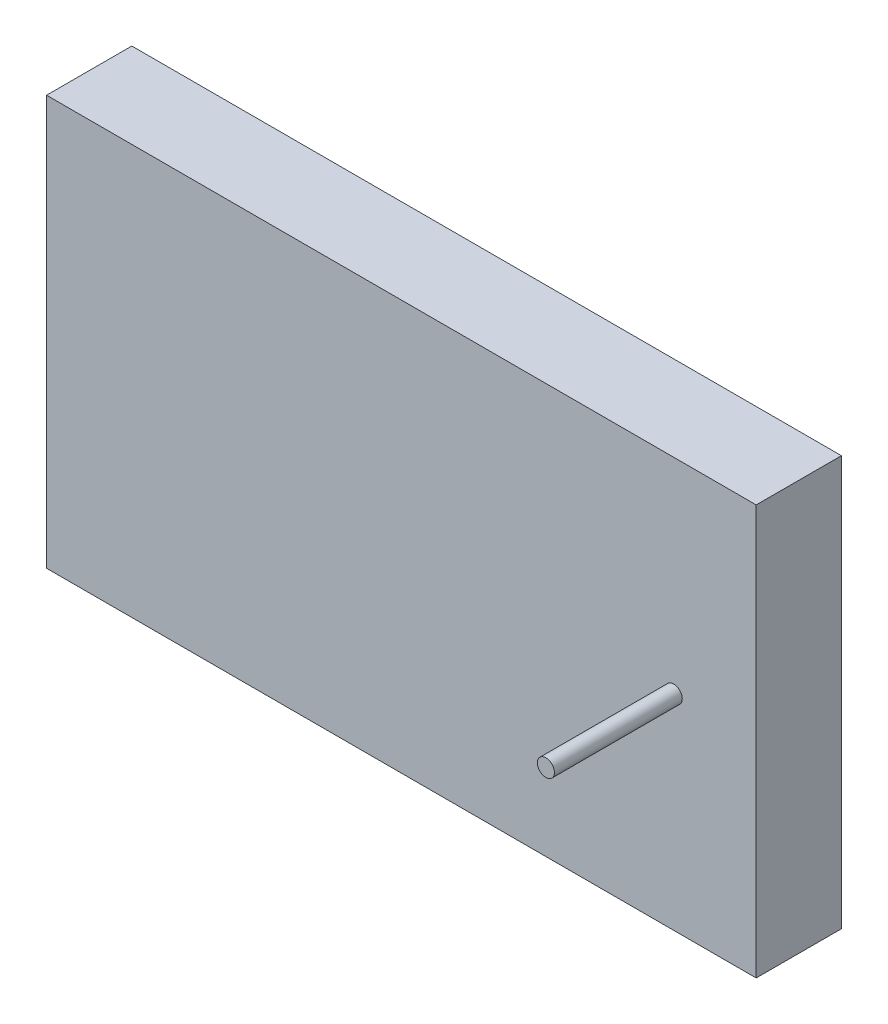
SolidWorks part; units mm, degrees
ref_plane "Ebene vorne" through (0, 0, 0) normal (0, 0, 1) x (1, 0, 0)
ref_plane "Ebene oben" through (0, 0, 0) normal (0, 1, 0) x (1, 0, 0)
ref_plane "Ebene rechts" through (0, 0, 0) normal (1, 0, 0) x (0, 0, -1)
sketch "Skizze1" plane through (0, 0, 0) normal (0, 0, 1) x (1, 0, 0)
  line L0 (0, 24.039) -> (83.2691, 24.039) construction
  line L1 (0, 0) -> (83.2691, 0)
  line L2 (0, 0) -> (0, 48.078)
  line L3 (0, 48.078) -> (83.2691, 48.078)
  line L4 (83.2691, 0) -> (83.2691, 48.078)
  line L5 (41.6346, 48.078) -> (41.6346, 0) construction
ref_plane "Ebene1" through (0, 24.039, 0) normal (0, 1, 0) x (-1, 0, 0)
sketch "Skizze2" plane through (0, 24.039, 0) normal (0, 1, 0) x (-1, 0, 0)
  line L0 (-74.5926, 0) -> (-74.5926, 25)
  line L1 (0, 0) -> (-83.2691, 0) construction
  line L2 (-74.5926, 25) -> (-73.5926, 25)
  line L3 (-73.5926, 33.1285) -> (-73.5926, 0) construction
  line L4 (-74.5926, 10) -> (-73.5926, 10) construction
  line L5 (-73.5926, 25) -> (-73.5926, 0)
  line L6 (-73.5926, 0) -> (-74.5926, 0)
  dimension "D1" = 10
  dimension "D2" = 25
  dimension "D3" = 2
revolve "Rotation1" add sketch "Skizze2" angle 360 about L3
extrude "Linear austragen1" add sketch "Skizze1" along normal up to vertex (10 mm away)
equation "\"LÄNGE\"=0"
equation "\"BREITE\"=0"
equation "\"HÖHE\"=0"
equation "\"DURCHMESSER\"=0"
equation "\"Stückzahl\"= 1"
equation "\"GESAMTHOEHE\"=\"D2@Skizze2\""
equation "\"KÖRPERHOEHE\"=\"D1@Skizze2\""
